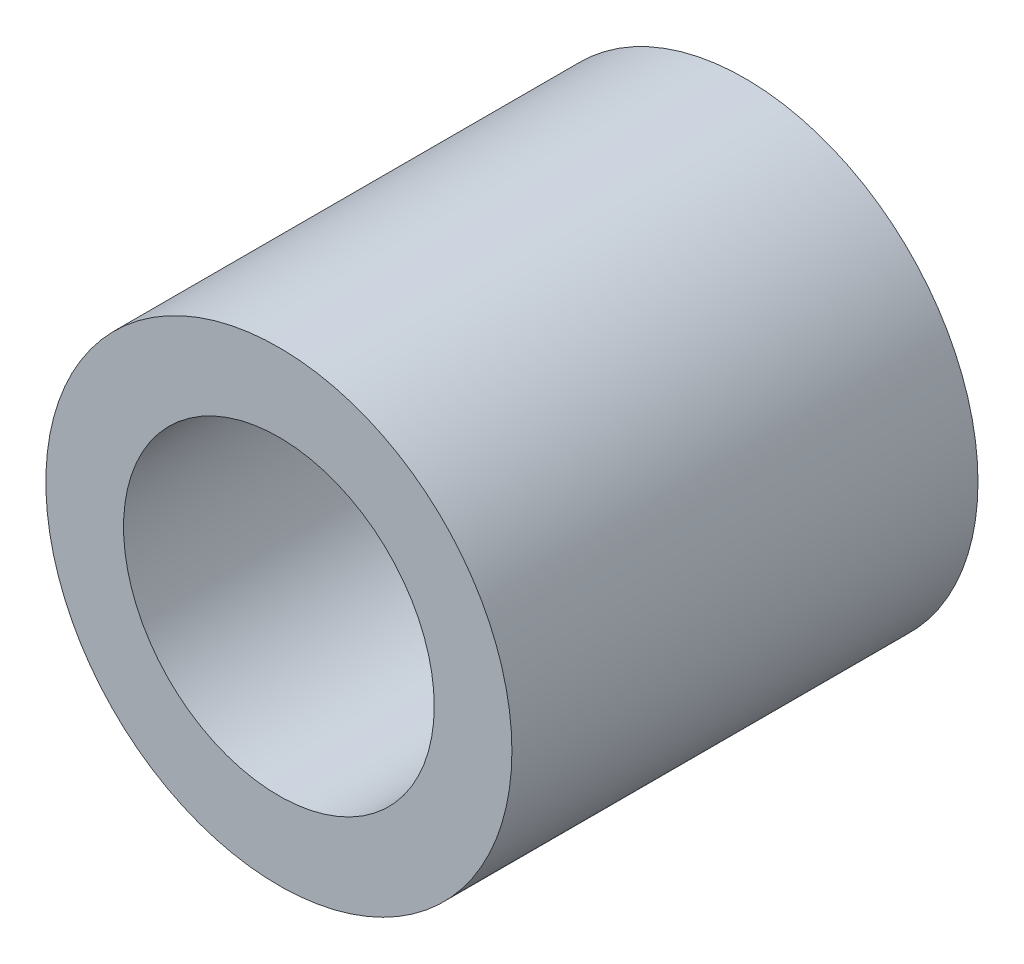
SolidWorks part; units mm, degrees
ref_plane "Plan de face" through (0, 0, 0) normal (0, 0, 1) x (1, 0, 0)
ref_plane "Plan de dessus" through (0, 0, 0) normal (0, 1, 0) x (1, 0, 0)
ref_plane "Plan de droite" through (0, 0, 0) normal (1, 0, 0) x (0, 0, -1)
sketch "Esquisse1" plane through (0, 0, 0) normal (0, 0, 1) x (1, 0, 0)
  circle A0 centre (0, 0) radius 3
  circle A1 centre (0, 0) radius 2
extrude "Extrusion1" add sketch "Esquisse1" along normal blind 6
